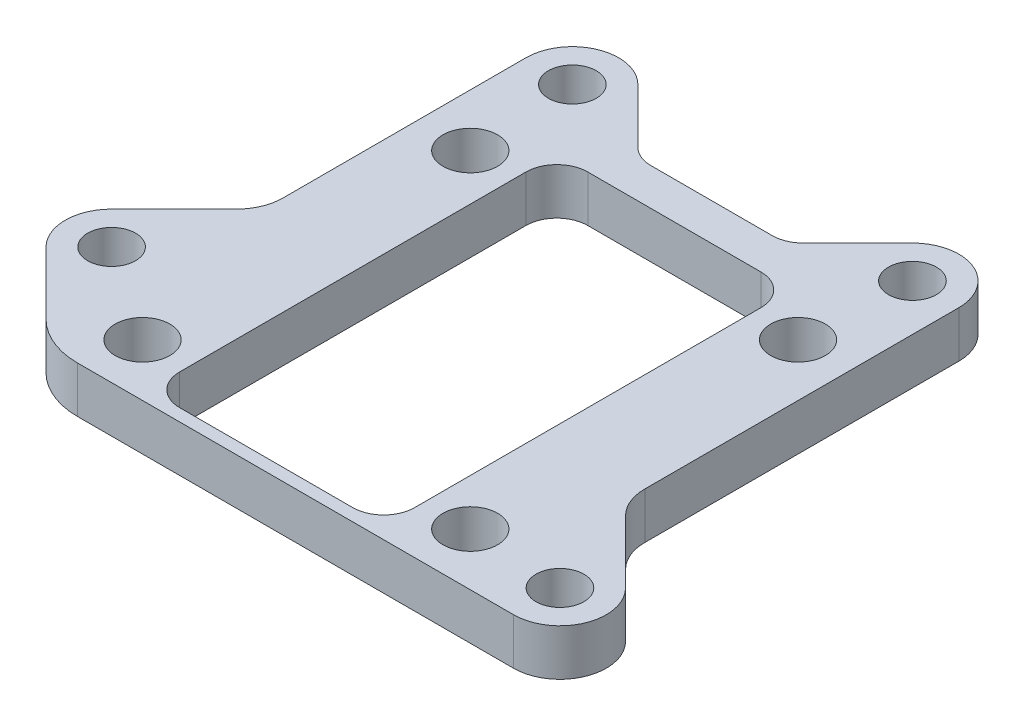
SolidWorks part; units mm, degrees
ref_plane "Front Plane" through (0, 0, 0) normal (0, 0, 1) x (1, 0, 0)
ref_plane "Top Plane" through (0, 0, 0) normal (0, 1, 0) x (1, 0, 0)
ref_plane "Right Plane" through (0, 0, 0) normal (1, 0, 0) x (0, 0, -1)
sketch "Sketch1" plane through (0, 0, 0) normal (0, 1, 0) x (1, 0, 0)
  line L0 (0, 0) -> (0, -44.137) construction
  line L1 (-6.2372, 24.765) -> (6.2372, 24.765)
  line L2 (-22.225, 2.9929) -> (-22.225, 27.94)
  line L3 (-23.6199, -0.3747) -> (-30.0376, -6.7924)
  line L4 (22.225, -4.3096) -> (22.225, 27.94)
  line L5 (-26.67, -10.16) -> (-42.4147, -10.16) construction
  line L6 (23.6199, -7.6772) -> (30.0376, -14.0949)
  line L7 (-8.89, -20.955) -> (8.89, -20.955)
  line L8 (-12.065, -17.78) -> (-12.065, 17.78)
  line L9 (-8.89, 20.955) -> (8.89, 20.955)
  line L10 (12.065, -17.78) -> (12.065, 17.78)
  line L11 (-12.065, -20.955) -> (12.065, 20.955) construction
  line L12 (-12.065, 20.955) -> (12.065, -20.955) construction
  line L13 (0, 0) -> (-31.5072, 0) construction
  line L14 (-30.0376, -13.5276) -> (-23.6199, -19.9453)
  line L15 (-18.1162, -22.225) -> (26.67, -22.225)
  line L16 (-8.4822, 25.6949) -> (-14.0949, 31.3076)
  line L17 (8.4822, 25.6949) -> (14.0949, 31.3076)
  arc A0 (-30.0376, -13.5276) -> (-30.0376, -6.7924) centre (-26.67, -10.16) cw
  arc A1 (26.67, -22.225) -> (30.0376, -14.0949) centre (26.67, -17.4625) ccw
  arc A2 (-22.225, 27.94) -> (-14.0949, 31.3076) centre (-17.4625, 27.94) cw
  arc A3 (14.0949, 31.3076) -> (22.225, 27.94) centre (17.4625, 27.94) cw
  arc A4 (23.6199, -7.6772) -> (22.225, -4.3096) centre (26.9875, -4.3096) cw
  arc A5 (-22.225, 2.9929) -> (-23.6199, -0.3747) centre (-26.9875, 2.9929) cw
  arc A6 (8.4822, 25.6949) -> (6.2372, 24.765) centre (6.2372, 27.94) cw
  arc A7 (-8.4822, 25.6949) -> (-6.2372, 24.765) centre (-6.2372, 27.94) ccw
  arc A8 (-12.065, 17.78) -> (-8.89, 20.955) centre (-8.89, 17.78) cw
  arc A9 (8.89, 20.955) -> (12.065, 17.78) centre (8.89, 17.78) cw
  arc A10 (8.89, -20.955) -> (12.065, -17.78) centre (8.89, -17.78) ccw
  arc A11 (-8.89, -20.955) -> (-12.065, -17.78) centre (-8.89, -17.78) cw
  arc A12 (-18.1162, -22.225) -> (-23.6199, -19.9453) centre (-18.1162, -14.4416) cw
  point P0 (0, 0)
  point P6 (0, 0)
  point P25 (22.225, -6.2823)
  point P28 (-26.67, -10.16)
  point P34 (12.6677, -22.225)
  point P37 (-12.6677, -22.225)
  point P54 (1.1797, 22.225)
  point P57 (-1.1797, 22.225)
  dimension "D5" = 4.7625
  dimension "D6" = 44.45
  dimension "D7" = 4.7625
  dimension "D10" = 4.7625
  dimension "D4" = 3.81
  dimension "D14" = 3.175
  dimension "D15" = 4.7625
  dimension "D12" = 3.175
  dimension "D18" = 4.7625
  dimension "D2" = 24.13
  dimension "D3" = 41.91
  dimension "D8" = 17.4625
  dimension "D9" = 26.67
  dimension "D11" = 22.225
  dimension "D13" = 45
  dimension "D16" = 27.94
  dimension "D17" = 135
  dimension "D19" = 26.67
  dimension "D20" = 135
  dimension "D21" = 10.16
extrude "Boss-Extrude1" add sketch "Sketch1" along normal blind 4.7625
hole_wizard "#2 (0.221) Diameter Hole1" positions "Sketch3" profile "Sketch2" hole size "#2" standard "ANSI Inch"
sketch "Sketch3" plane through (0, 4.7625, 0) normal (0, 1, 0) x (1, 0, 0)
  line L1 (16.8275, -16.8275) -> (-16.8275, -16.8275)
  line L2 (16.8275, -16.8275) -> (16.8275, 16.8275)
  line L3 (16.8275, 16.8275) -> (-16.8275, 16.8275)
  line L4 (-16.8275, -16.8275) -> (-16.8275, 16.8275)
  line L5 (16.8275, -16.8275) -> (-16.8275, 16.8275) construction
  line L6 (16.8275, 16.8275) -> (-16.8275, -16.8275) construction
  point P1 (0, 0)
  point P2 (-16.8275, 16.8275)
  point P251 (16.8275, -16.8275)
  point P252 (16.8275, 16.8275)
  point P253 (-16.8275, -16.8275)
  dimension "D1" = 33.655
  dimension "D2" = 33.655
sketch "Sketch2" plane through (0, 4.7625, 0) normal (1, 0, 0) x (0, 0, 1)
  line L0 (0, 0) -> (0, 4.7625)
  line L1 (0, 4.7625) -> (2.8067, 4.7625)
  line L2 (2.8067, 4.7625) -> (2.8067, 0)
  line L5 (2.8067, 0) -> (0, 0)
  line L11 (0, -6.35) -> (0, 107.95) construction
  dimension "Thru Hole Dia." = 5.6134
  dimension "Thru Hole Depth" = 4.7625
hole_wizard "#10 (0.1935) Diameter Hole1" positions "Sketch5" profile "Sketch4" hole size "#10" standard "ANSI Inch"
sketch "Sketch5" plane through (0, 4.7625, 0) normal (0, 1, 0) x (1, 0, 0)
  arc A0 (-14.0949, 31.3076) -> (-22.225, 27.94) centre (-17.4625, 27.94) ccw construction
  arc A1 (22.225, 27.94) -> (14.0949, 31.3076) centre (17.4625, 27.94) ccw construction
  arc A2 (-30.0376, -6.7924) -> (-30.0376, -13.5276) centre (-26.67, -10.16) ccw construction
  arc A3 (26.67, -22.225) -> (30.0376, -14.0949) centre (26.67, -17.4625) ccw construction
  point P0 (-17.4625, 27.94)
  point P3 (17.4625, 27.94)
  point P5 (-26.67, -10.16)
  point P7 (26.67, -17.4625)
sketch "Sketch4" plane through (-17.4625, 4.7625, -27.94) normal (1, 0, 0) x (0, 0, 1)
  line L0 (0, 0) -> (0, 4.7625)
  line L1 (0, 4.7625) -> (2.4574, 4.7625)
  line L2 (2.4574, 4.7625) -> (2.4574, 0)
  line L5 (2.4574, 0) -> (0, 0)
  line L11 (0, -6.35) -> (0, 107.95) construction
  dimension "Thru Hole Dia." = 4.9149
  dimension "Thru Hole Depth" = 4.7625
